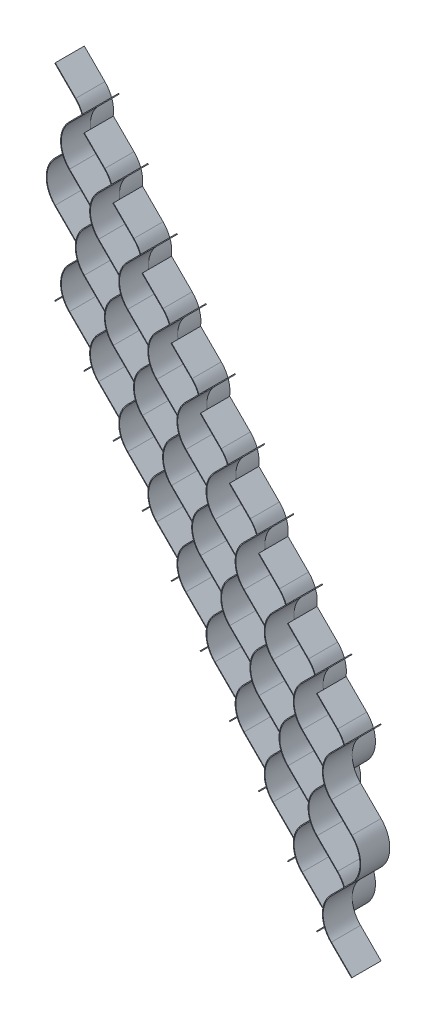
SolidWorks part; units mm, degrees
ref_plane "Ebene vorne" through (0, 0, 0) normal (0, 0, 1) x (1, 0, 0)
ref_plane "Ebene oben" through (0, 0, 0) normal (0, 1, 0) x (1, 0, 0)
ref_plane "Ebene rechts" through (0, 0, 0) normal (1, 0, 0) x (0, 0, -1)
sketch "Skizze3" plane through (0, 0, 0) normal (0, 0, 1) x (1, 0, 0)
  line L0 (0, 0) -> (7.0711, 7.0711)
  line L1 (7.0711, 21.2132) -> (0, 28.2843)
  line L2 (0, 42.4264) -> (7.0711, 49.4975)
  line L3 (7.0711, 63.6396) -> (0, 70.7107)
  line L4 (14.1421, 56.5685) -> (14.1421, 14.1421) construction
  line L5 (0, 0) -> (48.5161, 0) construction
  arc A0 (7.0711, 49.4975) -> (7.0711, 63.6396) centre (0, 56.5685) ccw
  arc A1 (7.0711, 21.2132) -> (7.0711, 7.0711) centre (0, 14.1421) cw
  arc A2 (0, 28.2843) -> (0, 42.4264) centre (7.0711, 35.3553) cw
  point P15 (-7.0711, 35.3553)
  dimension "D8" = 10
  dimension "D9" = 10
  dimension "D1" = 45
  dimension "D2" = 20
  dimension "D3" = 30
  dimension "D4" = 30
  dimension "D5" = 20
  dimension "D6" = 90
  dimension "D7" = 90
extrude "Linear-Austragen-Dünn1" add sketch "Skizze3" along normal blind 10 thin
sketch "Skizze6" plane through (0, 0, 10) normal (0, 0, 1) x (1, 0, 0)
  line L0 (20, 0) -> (12.9289, 7.0711)
  line L1 (12.9289, 21.2132) -> (20, 28.2843)
  line L2 (20, 42.4264) -> (12.9289, 49.4975)
  line L4 (12.9289, 63.6396) -> (20, 70.7107)
  line L5 (0, 0) -> (40.4503, 0) construction
  arc A0 (20, 28.2843) -> (20, 42.4264) centre (12.9289, 35.3553) ccw
  arc A1 (12.9289, 49.4975) -> (12.9289, 63.6396) centre (20, 56.5685) cw
  arc A2 (12.9289, 7.0711) -> (12.9289, 21.2132) centre (20, 14.1421) cw
  arc A3 (7.0711, 49.4975) -> (7.0711, 63.6396) centre (0, 56.5685) ccw construction
  arc A6 (7.0711, 7.0711) -> (7.0711, 21.2132) centre (0, 14.1421) ccw construction
  point P11 (27.0711, 35.3553)
  point P16 (5.8579, 56.5685)
  point P19 (5.8579, 14.1421)
  point P23 (-39.8343, 53.3422)
  dimension "D6" = 10
  dimension "D7" = 10
  dimension "D8" = 10
  dimension "D1" = 20
  dimension "D2" = 30
  dimension "D3" = 30
  dimension "D4" = 20
  dimension "D5" = 45
  dimension "D9" = 90
extrude "Linear-Austragen-Dünn2" add sketch "Skizze6" along normal blind 8 and the other way blind 2 thin
sketch "Skizze7" plane through (0, 0, 0) normal (0, 1, 0) x (1, 0, 0)
  line L0 (-2.9289, 0) -> (23.1789, -18) construction
  line L1 (23.2998, -16.0834) -> (-8.0365, 5.5214) construction
  line L2 (-5.1139, 3.5064) -> (-5.1139, 1.5064) construction
  line L3 (-2.9289, 0) -> (23.2998, -16.0834) construction
  dimension "D1" = 31.7115
  dimension "D2" = 2
pattern_linear "Lineares Muster2" count 10 spacing 30.35 along (0.8525, 0, 0.5227) of "Linear-Austragen-Dünn2", "Linear-Austragen-Dünn1"
